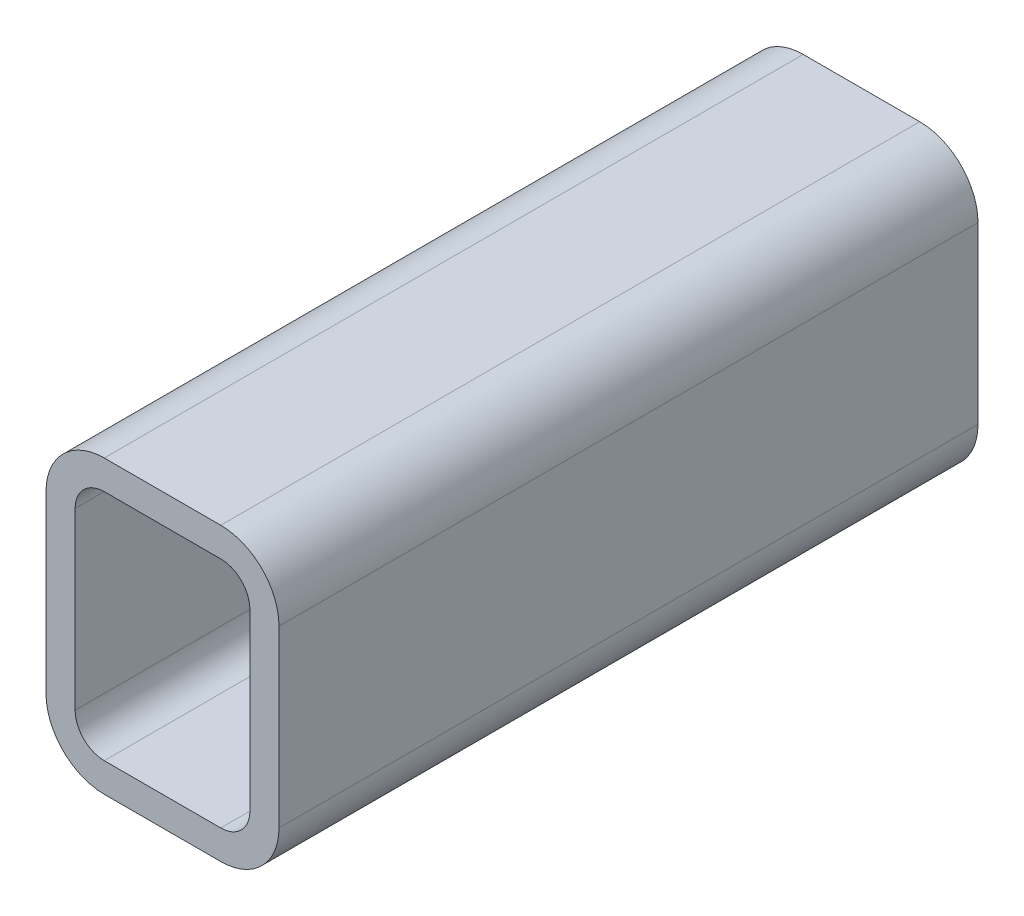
SolidWorks part; units mm, degrees
ref_plane "Front Plane" through (0, 0, 0) normal (0, 0, 1) x (1, 0, 0)
ref_plane "Top Plane" through (0, 0, 0) normal (0, 1, 0) x (1, 0, 0)
ref_plane "Right Plane" through (0, 0, 0) normal (1, 0, 0) x (0, 0, -1)
sketch "Sketch1" plane through (0, 0, 0) normal (0, 0, 1) x (1, 0, 0)
sketch_block_instance "HSS5x4x0.500-1"
sketch_block "HSS5x4x0.500"
extrude "Boss-Extrude1" add sketch "Sketch1" along normal blind 304.8
